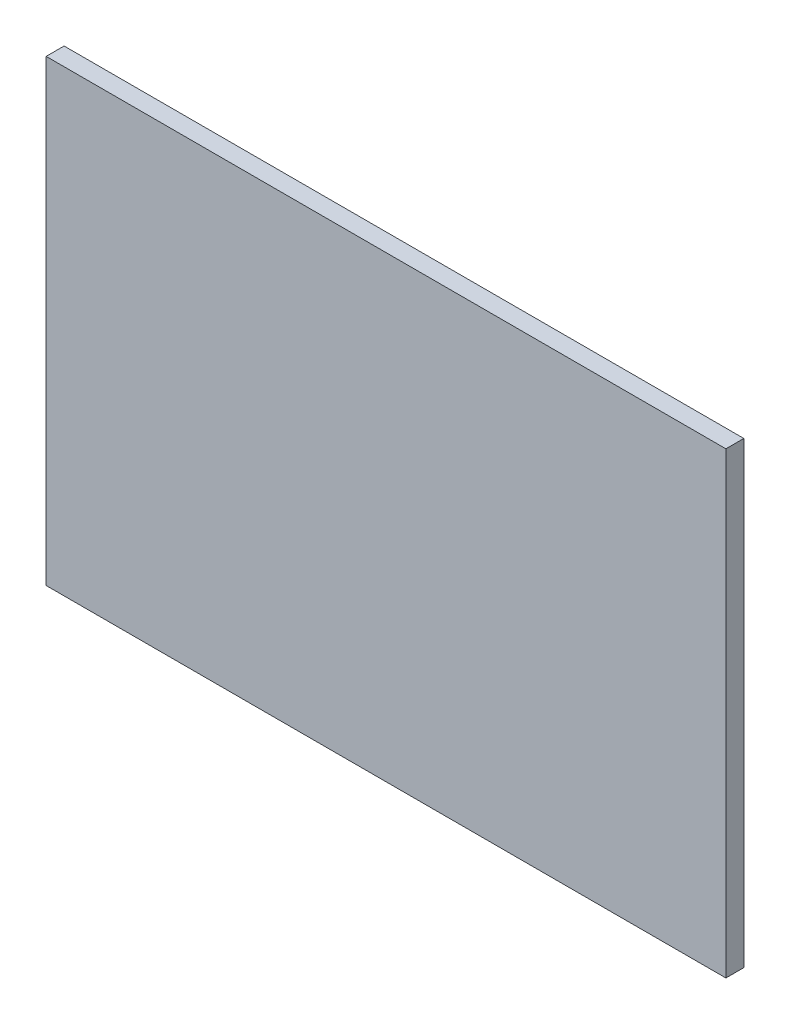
SolidWorks part; units mm, degrees
ref_plane "Alzado" through (0, 0, 0) normal (0, 0, 1) x (1, 0, 0)
ref_plane "Planta" through (0, 0, 0) normal (0, 1, 0) x (1, 0, 0)
ref_plane "Vista lateral" through (0, 0, 0) normal (1, 0, 0) x (0, 0, -1)
sketch "Croquis1" plane through (0, 0, 0) normal (0, 0, 1) x (1, 0, 0)
  line L1 (0, 0) -> (947, 0)
  line L2 (0, 0) -> (0, 638.5)
  line L3 (0, 638.5) -> (947, 638.5)
  line L4 (947, 0) -> (947, 638.5)
  dimension "D1" = 947
  dimension "D2" = 638.5
extrude "Saliente-Extruir1" add sketch "Croquis1" along normal blind 25
